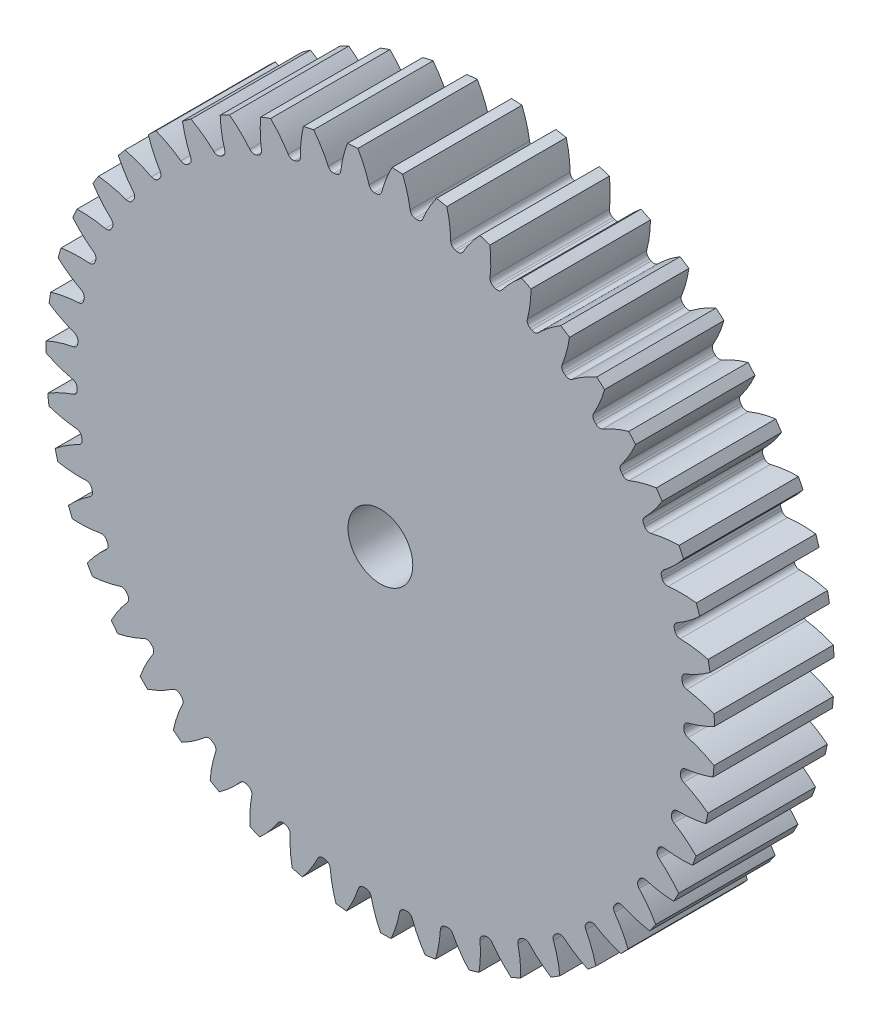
SolidWorks part; units mm, degrees
ref_plane "Front" through (0, 0, 0) normal (0, 0, 1) x (1, 0, 0)
ref_plane "Top" through (0, 0, 0) normal (0, 1, 0) x (1, 0, 0)
ref_plane "Right" through (0, 0, 0) normal (1, 0, 0) x (0, 0, -1)
sketch "Sketch3" plane through (0, 0, 0) normal (0, 0, 1) x (1, 0, 0)
  circle A0 centre (0, 0) radius 248.92
  dimension "od" = 497.84
extrude "gearBody" add sketch "Sketch3" along normal blind 88.9
sketch "Sketch2" plane through (0, 0, 0) normal (0, 0, 1) x (1, 0, 0)
  line L0 (0, 0) -> (207.2825, 85.8592) construction
  line L1 (248.4788, -17.0826) -> (0, 0) construction
  line L2 (0, 0) -> (36.3143, 0) construction
  line L3 (238.7292, 3.8327) -> (238.4552, -12.061) construction
  line L5 (238.5922, -4.1141) -> (0, 0) construction
  line L7 (0, 0) -> (224.361, 0) construction
  arc A0 (224.3608, -0.3125) -> (224.2382, -7.4228) centre (0, 0) ccw construction
  arc A1 (248.7772, 8.4291) -> (248.3387, -17.001) centre (0, 0) ccw construction
  arc A2 (238.7292, 3.8327) -> (238.4552, -12.061) centre (0, 0) ccw construction
  arc A3 (226.0127, -4.6228) -> (226.0377, -3.1721) centre (0, 0) ccw
  arc A4 (248.4788, -17.0826) -> (228.9805, -8.6745) centre (204.1992, -92.9546) ccw
  arc A5 (248.4788, -17.0826) -> (248.92, 8.5057) centre (0, 0) ccw
  arc A6 (248.92, 8.5057) -> (229.1434, 0.7749) centre (207.2825, 85.8592) cw
  arc A7 (226.0377, -3.1721) -> (229.1434, 0.7749) centre (230.1725, -3.2301) cw
  arc A8 (228.9805, -8.6745) -> (226.0127, -4.6228) centre (230.147, -4.7073) cw
  point P6 (248.92, 8.5057)
  point P22 (248.4788, -17.0826)
  dimension "baseDia" = 448.722
  dimension "od" = 497.84
  dimension "pd" = 477.52
  dimension "rd" = 452.12
  dimension "rFillet" = 4.1351
  dimension "pointX" = 248.92
  dimension "pointY" = 8.5057
  dimension "CTT" = 15.8937
  dimension "flankCenterAngle" = 22.5
extrude "toothCut" cut sketch "Sketch2" along normal through all
pattern_circular "CirPattern1" count 47 over 360 about axis through (0, 0, 0) along (0, 0, 1) of "toothCut"
sketch "hub1Dia" plane through (0, 0, 0) normal (0, 0, -1) x (-1, 0, 0)
  circle A0 centre (0, 0) radius 12.7
  dimension "hub1Dia" = 25.4
sketch "hub2Dia" plane through (0, 0, 88.9) normal (0, 0, 1) x (1, 0, 0)
  circle A0 centre (0, 0) radius 12.7
  dimension "hub2dia" = 25.4
sketch "boreDia" plane through (0, 0, 0) normal (0, 0, 1) x (1, 0, 0)
  circle A0 centre (0, 0) radius 24.13
  dimension "boreDia" = 48.26
extrude "bore" cut sketch "boreDia" against normal mid plane 25400
